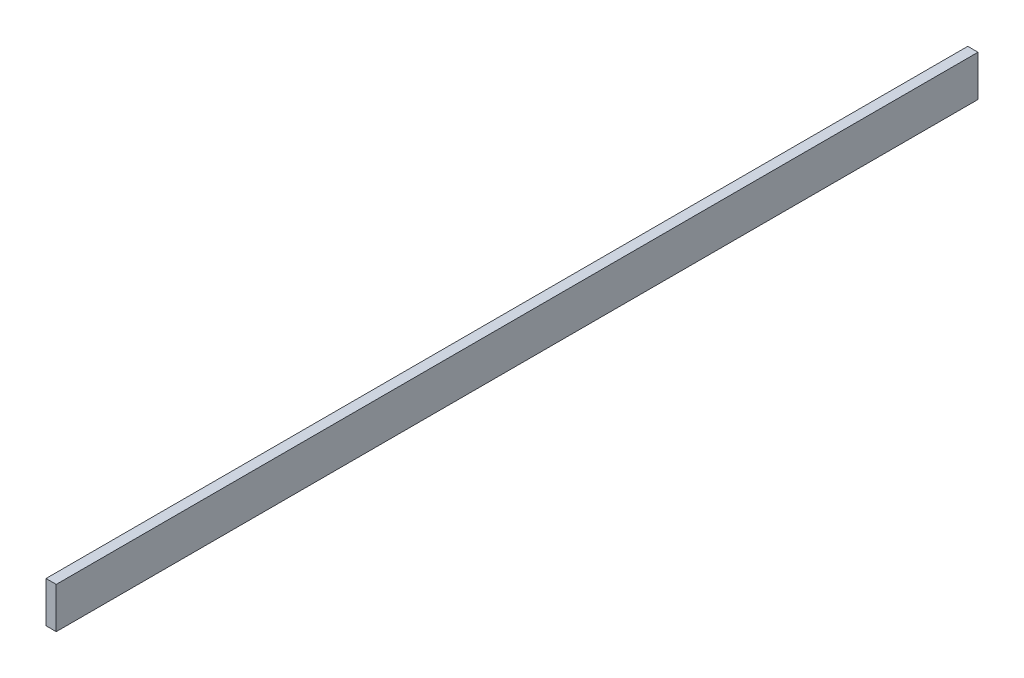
SolidWorks part; units mm, degrees
ref_plane "Front Plane" through (0, 0, 0) normal (0, 0, 1) x (1, 0, 0)
ref_plane "Top Plane" through (0, 0, 0) normal (0, 1, 0) x (1, 0, 0)
ref_plane "Right Plane" through (0, 0, 0) normal (1, 0, 0) x (0, 0, -1)
sketch "Sketch1" plane through (0, 0, 0) normal (0, 0, 1) x (1, 0, 0)
  line L1 (-12.7, -50.8) -> (12.7, -50.8)
  line L2 (-12.7, -50.8) -> (-12.7, 50.8)
  line L3 (-12.7, 50.8) -> (12.7, 50.8)
  line L4 (12.7, -50.8) -> (12.7, 50.8)
  line L5 (-12.7, -50.8) -> (12.7, 50.8) construction
  line L6 (-12.7, 50.8) -> (12.7, -50.8) construction
  point P0 (0, 0)
  dimension "D1" = 25.4
  dimension "D2" = 101.6
extrude "Boss-Extrude1" add sketch "Sketch1" along normal blind 2286
